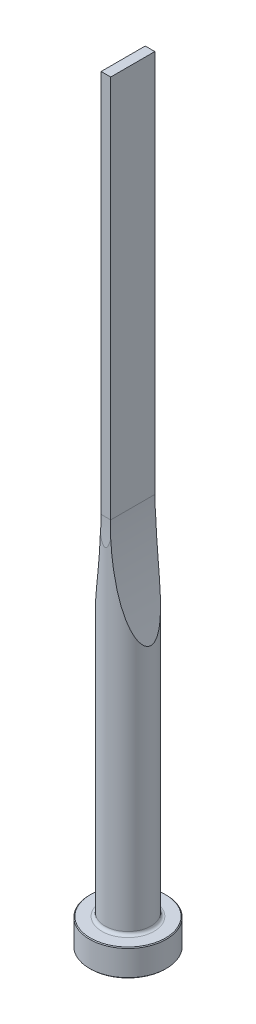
SolidWorks part; units mm, degrees
ref_plane "Front Plane" through (0, 0, 0) normal (0, 0, 1) x (1, 0, 0)
ref_plane "Top Plane" through (0, 0, 0) normal (0, 1, 0) x (1, 0, 0)
ref_plane "Right Plane" through (0, 0, 0) normal (1, 0, 0) x (0, 0, -1)
sketch "Sketch1" plane through (0, 0, 0) normal (0, 0, 1) x (1, 0, 0)
  line L0 (0, 0) -> (9.8, 0)
  line L1 (55, 0) -> (-55, 0) construction
  line L2 (10, 0.2) -> (10, 6.8)
  line L3 (9.8, 7) -> (6.8, 7)
  line L4 (6, 7.8) -> (6, 200)
  line L5 (0, 200) -> (6, 200)
  line L6 (10, 6.8) -> (9.8, 7)
  line L7 (9.8, 0) -> (10, 0.2)
  line L8 (0, 200) -> (0, 0)
  arc A0 (6, 7.8) -> (6.8, 7) centre (6.8, 7.8) ccw
  point P1 (10, 0)
  point P6 (10, 7)
  dimension "D4" = 0.8
  dimension "D1" = 6
  dimension "D2" = 10
  dimension "D3" = 7
  dimension "D5" = 200
revolve "Revolve1" add sketch "Sketch1" angle 360 about L8
sketch "Sketch2" plane through (0, 0, 0) normal (0, 0, 1) x (1, 0, 0)
  line L0 (1.25, 200) -> (1.25, 100)
  line L1 (6, 200) -> (-6, 200) construction
  line L2 (-1.25, 200) -> (-1.25, 100)
  line L3 (6, 200) -> (6, 71.148)
  line L4 (-6, 200) -> (-6, 71.148)
  line L5 (0, -11) -> (0, 11) construction
  line L6 (6, 200) -> (1.25, 200)
  line L8 (-1.25, 200) -> (-6, 200)
  arc A0 (1.25, 100) -> (6, 71.148) centre (91.25, 100) ccw
  arc A1 (-1.25, 100) -> (-6, 71.148) centre (-91.25, 100) cw
  dimension "D4" = 90
  dimension "D1" = 100
  dimension "D2" = 2.5
  dimension "D3" = 1.25
extrude "Cut-Extrude1" cut sketch "Sketch2" against normal mid plane 15
sketch "Sketch3" plane through (0, 0, 0) normal (1, 0, 0) x (0, 0, -1)
  line L0 (5.75, 200) -> (5.75, 100)
  line L1 (-5.8683, 200) -> (5.8683, 200) construction
  line L2 (-5.75, 200) -> (-5.75, 100)
  line L3 (6, 200) -> (6, 93.2965)
  line L4 (5.75, 200) -> (6, 200)
  line L5 (0, 11) -> (0, -11) construction
  line L6 (-6, 200) -> (-6, 93.2965)
  line L8 (-5.75, 200) -> (-6, 200)
  arc A0 (5.75, 100) -> (6, 93.2965) centre (95.75, 100) ccw
  arc A1 (-5.75, 100) -> (-6, 93.2965) centre (-95.75, 100) cw
  dimension "D2" = 90
  dimension "D1" = 100
  dimension "D3" = 11.5
  dimension "D4" = 5.75
extrude "Cut-Extrude2" cut sketch "Sketch3" against normal mid plane 15
